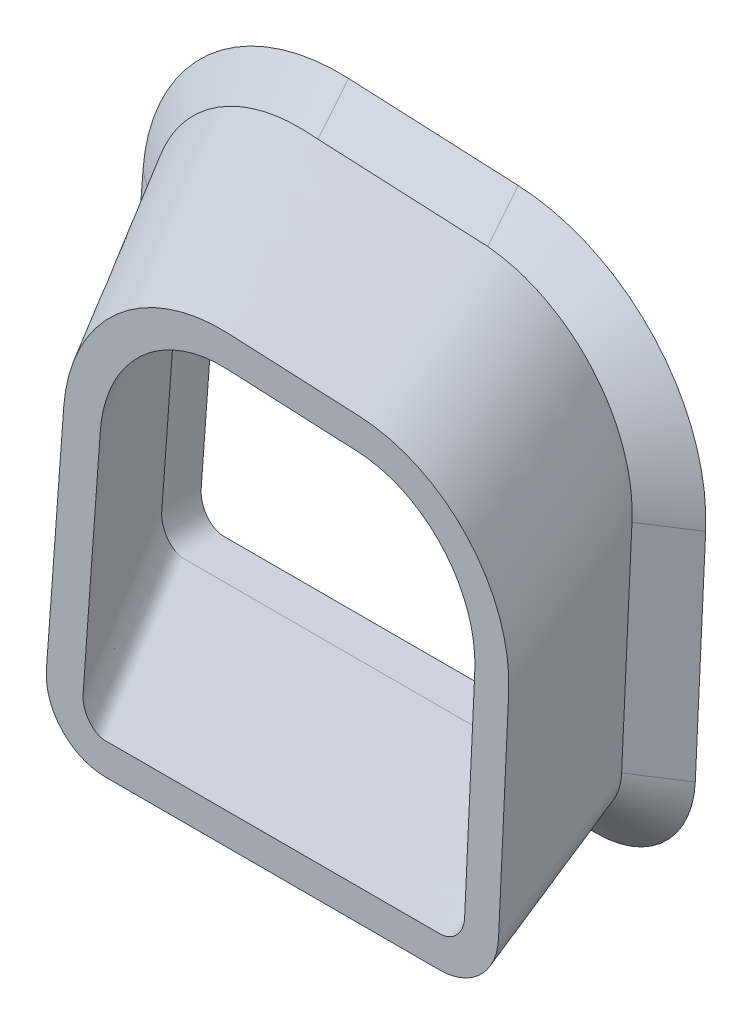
SolidWorks part; units mm, degrees
ref_plane "Спереди" through (0, 0, 0) normal (0, 0, 1) x (1, 0, 0)
ref_plane "Сверху" through (0, 0, 0) normal (0, 1, 0) x (1, 0, 0)
ref_plane "Справа" through (0, 0, 0) normal (1, 0, 0) x (0, 0, -1)
other "Configuration Table"
sketch "Эскиз1" plane through (0, 0, 0) normal (0, 0, 1) x (1, 0, 0)
  line L0 (-10.1901, -13.6844) -> (8.791, -13.6844)
  line L1 (13.7856, -8.9175) -> (14.3125, 2.3726)
  line L2 (4.7895, 12.8279) -> (-3.836, 13.2305)
  line L3 (-14.2753, 3.9727) -> (-15.1767, -8.3187)
  line L4 (-15.2035, -8.6844) -> (13.7965, -8.6844) construction
  line L5 (7.1965, -13.6844) -> (7.1965, 12.7156) construction
  line L6 (14.4965, 6.3156) -> (-14.1035, 6.3156) construction
  line L7 (-13.5631, 13.6844) -> (13.5631, -13.6844) construction
  arc A0 (8.791, -13.6844) -> (13.7856, -8.9175) centre (8.791, -8.6844) ccw
  arc A1 (-10.1901, -13.6844) -> (-15.1767, -8.3187) centre (-10.1901, -8.6844) cw
  arc A2 (-3.836, 13.2305) -> (-14.2753, 3.9727) centre (-4.3021, 3.2413) ccw
  arc A3 (14.3125, 2.3726) -> (4.7895, 12.8279) centre (4.3233, 2.8388) ccw
  point P8 (0, 0)
  dimension "D8" = 5
  dimension "D9" = 5
  dimension "D10" = 10
  dimension "D11" = 10
  dimension "D1" = 29
  dimension "D2" = 5
  dimension "D3" = 6.6
  dimension "D4" = 7.3
  dimension "D5" = 20
  dimension "D6" = 21.3
  dimension "D7" = 26.4
sketch "Эскиз14" plane through (0, 0, 0) normal (0, 0, 1) x (1, 0, 0)
  line L9 (-12.2807, 3.8264) -> (-13.1821, -8.465)
  line L10 (-10.1901, -11.6844) -> (8.791, -11.6844)
  line L11 (11.7878, -8.8242) -> (12.3146, 2.4659)
  line L12 (4.6963, 10.8301) -> (-3.9292, 11.2326)
  line L13 (-12.2807, 3.8264) -> (-13.1821, -8.465)
  line L14 (-10.1901, -11.6844) -> (8.791, -11.6844)
  line L15 (11.7878, -8.8242) -> (12.3146, 2.4659)
  line L16 (4.6963, 10.8301) -> (-3.9292, 11.2326)
  arc A8 (-13.1821, -8.465) -> (-10.1901, -11.6844) centre (-10.1901, -8.6844) ccw
  arc A9 (8.791, -11.6844) -> (11.7878, -8.8242) centre (8.791, -8.6844) ccw
  arc A10 (12.3146, 2.4659) -> (4.6963, 10.8301) centre (4.3233, 2.8388) ccw
  arc A11 (-3.9292, 11.2326) -> (-12.2807, 3.8264) centre (-4.3021, 3.2413) ccw
  arc A12 (-13.1821, -8.465) -> (-10.1901, -11.6844) centre (-10.1901, -8.6844) ccw
  arc A13 (8.791, -11.6844) -> (11.7878, -8.8242) centre (8.791, -8.6844) ccw
  arc A14 (12.3146, 2.4659) -> (4.6963, 10.8301) centre (4.3233, 2.8388) ccw
  arc A15 (-3.9292, 11.2326) -> (-12.2807, 3.8264) centre (-4.3021, 3.2413) ccw
  dimension "D1" = 2
sketch "Эскиз15" plane through (0, 0, 0) normal (0, 1, 0) x (1, 0, 0)
  line L0 (-12.5613, 0) -> (-6.5613, -10)
  line L1 (12.1996, 0) -> (12.1996, -10) construction
  line L2 (12.1996, -10) -> (16.1996, -10) construction
  line L3 (-12.5613, 0) -> (-12.5613, -10) construction
  line L4 (-12.5613, -10) -> (-6.5613, -10) construction
  line L5 (16.1996, -10) -> (12.1996, 0)
  dimension "D1" = 10
  dimension "D2" = 6
  dimension "D3" = 4
ref_plane "Плоскость6" through (0, 0, 10) normal (0, 0, 1) x (1, 0, 0)
sketch "Эскиз21" plane through (0, 0, 10) normal (0, 0, 1) x (1, 0, 0)
  line L0 (-10.1901, -11.6844) -> (8.791, -11.6844) construction
  line L1 (4.6963, 10.8301) -> (-3.9292, 11.2326) construction
  line L8 (15.7878, -8.8242) -> (16.306, 2.2796)
  line L9 (8.6876, 10.6438) -> (2.0503, 10.9536)
  line L10 (-6.3012, 3.5474) -> (-7.1821, -8.465)
  line L11 (-4.1901, -11.6844) -> (12.791, -11.6844)
  arc A8 (16.306, 2.2796) -> (8.6876, 10.6438) centre (8.3147, 2.6525) ccw
  arc A9 (2.0503, 10.9536) -> (-6.3012, 3.5474) centre (1.6774, 2.9623) ccw
  arc A10 (-7.1821, -8.465) -> (-4.1901, -11.6844) centre (-4.1901, -8.6844) ccw
  arc A11 (12.791, -11.6844) -> (15.7878, -8.8242) centre (12.791, -8.6844) ccw
  dimension "D1" = 8
  dimension "D2" = 8
  dimension "D3" = 3
  dimension "D4" = 3
  dimension "D6" = 85.806
  dimension "D8" = 92.672
loft "По сечениям4" add profiles "Эскиз21", "Эскиз14"
shell "Оболочка1" thickness 1.6
extrude "Бобышка-Вытянуть5" add sketch "Эскиз1" against normal blind 2
chamfer "Фаска2" distance 2 angle 54 8 edges at (-14.726, -2.173, 0) (-13.8526, -12.0882, 0) (-10.9371, 10.7231, 0) (-0.6995, -13.6844, 0) (0.4768, 13.0292, 0) (12.2432, -12.3014, 0) (11.7163, 9.5726, 0) (14.049, -3.2724, 0)
sketch "Эскиз16" plane through (0, 0, 0) normal (0, 0, 1) x (1, 0, 0)
  spline S1 degree 3 number of poles 102 (6.4508, 8.8632) -> (6.4508, 8.8632)
  spline S2 degree 3 number of poles 102 (6.4508, 8.8632) -> (6.4508, 8.8632)
  dimension "D1" = 0
extrude "Вырез-Вытянуть1" cut sketch "Эскиз16" against normal blind 2
sketch "Эскиз17" plane through (0, 0, 0) normal (0, 1, 0) x (1, 0, 0)
  line L0 (-15.1767, 2) -> (14.3125, 2) construction
  line L1 (-15.1767, 2) -> (10.2604, 12.1525)
  line L2 (10.2604, 12.1525) -> (14.3125, 2) construction
  line L4 (16.3145, -10) -> (12.1541, 0.424) construction
ref_plane "Плоскость3" through (0, 0, 0) normal (0, -1, 0) x (0.9288, 0, -0.3707)
ref_plane "Плоскость4" through (-2.774, 0, -6.9502) normal (-0.3707, 0, -0.9288) x (0.9288, 0, -0.3707)
ref_plane "Плоскость5" through (-6.4808, 0, -16.2378) normal (-0.3707, 0, -0.9288) x (0.9288, 0, -0.3707)
sketch "Эскиз18" plane through (-6.4808, 0, -16.2378) normal (-0.3707, 0, -0.9288) x (0.9288, 0, -0.3707)
  circle A0 centre (0, 0) radius 8
  circle A1 centre (0, 0) radius 6.4
  dimension "D1" = 16
  dimension "D2" = 1.6
sketch "Эскиз19" plane through (0, 0, -2) normal (0, 0, -1) x (-1, 0, 0)
  line L4 (-8.791, -13.6844) -> (10.1901, -13.6844)
  line L6 (-8.791, -13.6844) -> (10.1901, -13.6844)
  line L24 (15.1767, -8.3187) -> (14.2753, 3.9727)
  line L26 (15.1767, -8.3187) -> (14.2753, 3.9727)
  line L32 (3.836, 13.2305) -> (-4.7895, 12.8279)
  line L33 (3.836, 13.2305) -> (-4.7895, 12.8279)
  line L34 (-14.3125, 2.3726) -> (-13.7856, -8.9175)
  line L35 (-14.3125, 2.3726) -> (-13.7856, -8.9175)
  arc A4 (-13.7856, -8.9175) -> (-8.791, -13.6844) centre (-8.791, -8.6844) ccw
  arc A6 (-13.7856, -8.9175) -> (-8.791, -13.6844) centre (-8.791, -8.6844) ccw
  arc A20 (10.1901, -13.6844) -> (15.1767, -8.3187) centre (10.1901, -8.6844) ccw
  arc A22 (10.1901, -13.6844) -> (15.1767, -8.3187) centre (10.1901, -8.6844) ccw
  arc A28 (14.2753, 3.9727) -> (3.836, 13.2305) centre (4.3021, 3.2413) ccw
  arc A29 (14.2753, 3.9727) -> (3.836, 13.2305) centre (4.3021, 3.2413) ccw
  arc A30 (-4.7895, 12.8279) -> (-14.3125, 2.3726) centre (-4.3233, 2.8388) ccw
  arc A31 (-4.7895, 12.8279) -> (-14.3125, 2.3726) centre (-4.3233, 2.8388) ccw
  dimension "D1" = 0
sketch "Эскиз25" plane through (0, 0, -2) normal (0, 0, -1) x (-1, 0, 0)
  spline S1 degree 3 number of poles 103 (-6.4508, 8.8632) -> (-6.4508, 8.8632)
  spline S2 degree 3 number of poles 103 (-6.4508, 8.8632) -> (-6.4508, 8.8632)
  dimension "D1" = 0
sketch3d "Трехмерный эскиз1"
  line L0 (11.6186, -8.8163, -0.4239) -> (16.0469, -3.2723, 10)
  line L1 (15.7878, -8.8242, 10) -> (16.306, 2.2796, 10) construction
  line L2 (16.0469, -3.2723, 10) -> (12.1455, 2.4738, -0.4239)
  line L3 (12.1455, 2.4738, -0.4239) -> (11.6186, -8.8163, -0.4239)
  line L4 (11.882, -3.1713, -0.4239) -> (16.0469, -3.2723, 10) construction
ref_plane "верхняя ровность" through (10.4972, -0.4899, -4.1989) normal (-0.9276, 0.0433, 0.371) x (0.3706, -0.0173, 0.9286)
sketch "Эскиз26" plane through (0, 0, -2) normal (0, 0, -1) x (-1, 0, 0)
  line L0 (-8.791, -8.6844) -> (4.3021, 3.2413) construction
  line L1 (10.1901, -8.6844) -> (-4.3233, 2.8388) construction
  line L2 (-4.3233, 2.8388) -> (-4.0784, -4.392)
  line L3 (-4.0784, -4.392) -> (0.0489, -0.6326)
  line L4 (-8.791, -13.6844) -> (10.1901, -13.6844)
  line L5 (15.1767, -8.3187) -> (14.2753, 3.9727)
  line L6 (3.836, 13.2305) -> (-4.7895, 12.8279)
  line L7 (-14.3125, 2.3726) -> (-13.7856, -8.9175)
  line L8 (-8.791, -13.6844) -> (10.1901, -13.6844)
  line L9 (15.1767, -8.3187) -> (14.2753, 3.9727)
  line L10 (3.836, 13.2305) -> (-4.7895, 12.8279)
  line L11 (-14.3125, 2.3726) -> (-13.7856, -8.9175)
  line L12 (0.0489, -0.6326) -> (-4.3233, 2.8388)
  arc A4 (-13.7856, -8.9175) -> (-8.791, -13.6844) centre (-8.791, -8.6844) ccw
  arc A5 (10.1901, -13.6844) -> (15.1767, -8.3187) centre (10.1901, -8.6844) ccw
  arc A6 (14.2753, 3.9727) -> (3.836, 13.2305) centre (4.3021, 3.2413) ccw
  arc A7 (-4.7895, 12.8279) -> (-14.3125, 2.3726) centre (-4.3233, 2.8388) ccw
  arc A8 (-13.7856, -8.9175) -> (-8.791, -13.6844) centre (-8.791, -8.6844) ccw
  arc A9 (10.1901, -13.6844) -> (15.1767, -8.3187) centre (10.1901, -8.6844) ccw
  arc A10 (14.2753, 3.9727) -> (3.836, 13.2305) centre (4.3021, 3.2413) ccw
  arc A11 (-4.7895, 12.8279) -> (-14.3125, 2.3726) centre (-4.3233, 2.8388) ccw
  point P0 (0.0489, -0.6326)
  dimension "D1" = 0
ref_plane "Плоскость8" through (-0.0489, -0.6326, -2) normal (-0.0339, -0.9994, 0) x (-0.9994, 0.0339, 0)
